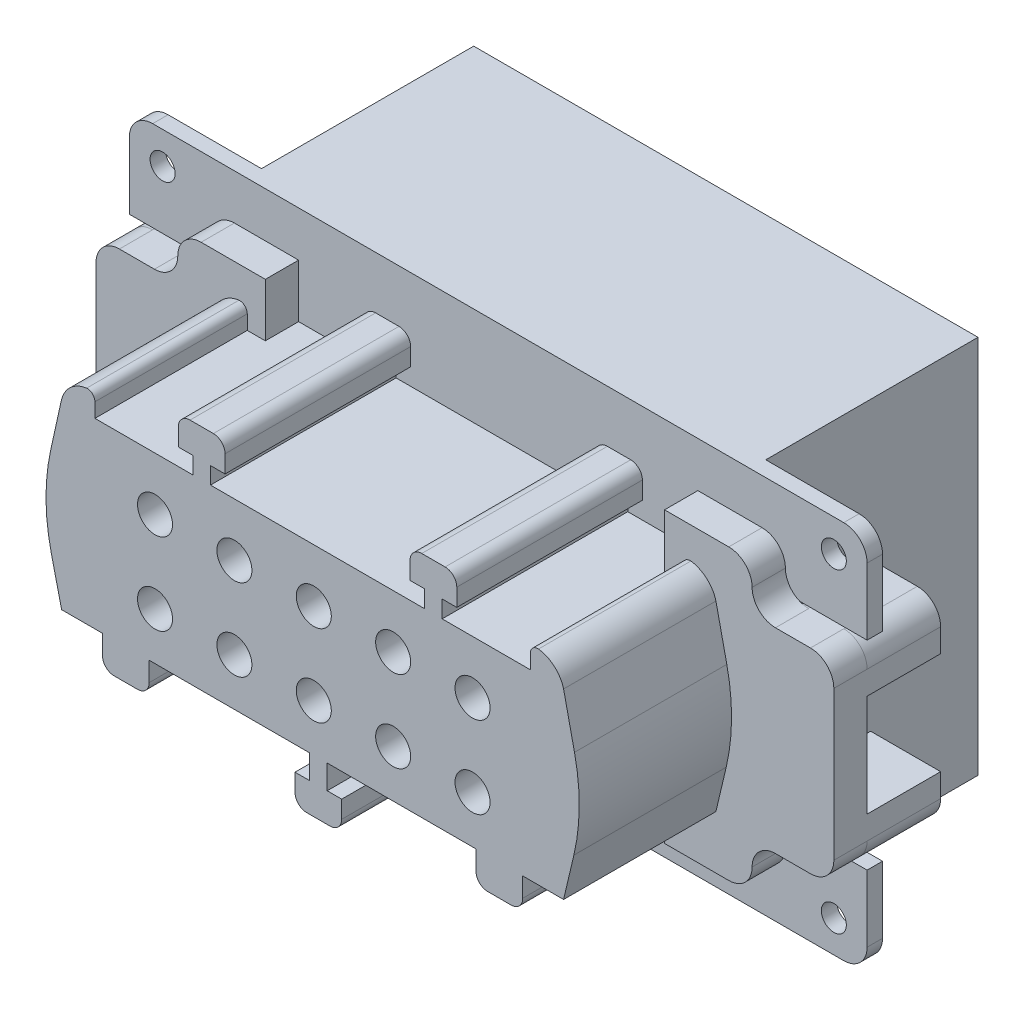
SolidWorks part; units mm, degrees
ref_plane "Front Plane" through (0, 0, 0) normal (0, 0, 1) x (1, 0, 0)
ref_plane "Top Plane" through (0, 0, 0) normal (0, 1, 0) x (1, 0, 0)
ref_plane "Right Plane" through (0, 0, 0) normal (1, 0, 0) x (0, 0, -1)
sketch "Sketch2" plane through (0, 0, 0) normal (0, 0, 1) x (1, 0, 0)
  line L0 (51.3412, 71.9453) -> (256.7061, 71.9453) construction
  line L1 (-14, -7.81) -> (-0.25, -7.81)
  line L2 (-21.5, -7.81) -> (-18, -7.81)
  line L4 (-18.6481, 7.81) -> (-10.25, 7.81)
  line L6 (-22.3805, -4.0782) -> (-21.5, -7.81)
  line L7 (-18.6481, 7.81) -> (-18.6481, 9.0397)
  line L8 (14, -7.81) -> (14, -10.47)
  line L13 (0, 16.6278) -> (0, -17.3382) construction
  line L15 (21.5, -7.81) -> (22.3805, -4.0782)
  line L16 (-21.5, -7.81) -> (21.5, 7.81) construction
  line L17 (-21.5, 7.81) -> (21.5, -7.81) construction
  line L18 (0.5, -13.0336) -> (0.5, -8.7302) construction
  line L19 (-18, -7.81) -> (-18, -10.47)
  line L20 (-18, -10.47) -> (-14, -10.47)
  line L21 (-14, -7.81) -> (-14, -10.47)
  line L22 (2.492, -12.3678) -> (-1.508, -12.3678)
  line L23 (2.492, -12.3678) -> (2.492, -9.8678)
  line L24 (2.492, -9.8678) -> (1.25, -9.8678)
  line L25 (-1.508, -12.3678) -> (-1.508, -9.8678)
  line L27 (-11.5, 9.2586) -> (-10.25, 9.2586)
  line L28 (-11.5, 9.2586) -> (-11.5, 11.7586)
  line L29 (-11.5, 11.7586) -> (-7.5, 11.7586)
  line L30 (-7.5, 9.2586) -> (-7.5, 11.7586)
  line L31 (8.35, 9.2858) -> (9.6, 9.2858)
  line L32 (8.35, 9.2858) -> (8.35, 11.7858)
  line L33 (-8.75, 9.2586) -> (-7.5, 9.2586)
  line L34 (8.35, 11.7858) -> (12.35, 11.7858)
  line L35 (12.35, 9.2858) -> (12.35, 11.7858)
  line L36 (1.25, -7.81) -> (14, -7.81)
  line L37 (-0.25, -9.8678) -> (-1.508, -9.8678)
  line L38 (-0.25, -7.81) -> (-0.25, -9.8678)
  line L39 (10.35, 12.8578) -> (10.35, 6.7253) construction
  line L40 (1.25, -7.81) -> (1.25, -9.8678)
  line L41 (-9.5, 14.8285) -> (-9.5, 6.5304) construction
  line L42 (11.1, 9.2858) -> (12.35, 9.2858)
  line L44 (9.6, 7.81) -> (9.6, 9.2858)
  line L45 (11.1, 7.81) -> (18.6481, 7.81)
  line L46 (11.1, 7.81) -> (11.1, 9.2858)
  line L48 (-10.25, 7.81) -> (-10.25, 9.2586)
  line L49 (-8.75, 7.81) -> (9.6, 7.81)
  line L50 (-8.75, 7.81) -> (-8.75, 9.2586)
  line L51 (18.6481, 7.81) -> (18.6481, 9.0397)
  line L52 (18, -10.47) -> (14, -10.47)
  line L53 (18, -7.81) -> (18, -10.47)
  line L54 (18, -7.81) -> (21.5, -7.81)
  line L57 (22.4335, 3.5745) -> (21.5, 7.81)
  line L68 (-22.4335, 3.5745) -> (-21.5, 7.81)
  arc A0 (-21.5, 7.81) -> (-19.3531, 9.7021) centre (-19.0071, 7.1455) cw
  arc A1 (-18.6481, 9.0397) -> (-19.3531, 9.7021) centre (-19.3118, 9.0397) ccw
  arc A2 (-22.3805, -4.0782) -> (-22.4335, 3.5745) centre (-5.6707, -0.1358) cw
  arc A8 (18.6481, 9.0397) -> (19.3531, 9.7021) centre (19.3118, 9.0397) cw
  arc A9 (22.3805, -4.0782) -> (22.4335, 3.5745) centre (5.6707, -0.1358) ccw
  arc A30 (21.5, 7.81) -> (19.3531, 9.7021) centre (19.0071, 7.1455) ccw
  point P2 (0, 0)
  point P36 (0, 1.0857)
  point P126 (0, 10.3439)
  point P128 (0, -12.569)
  point P134 (0, 28.6986)
  dimension "D1" = 15.62
  dimension "D2" = 43
  dimension "D14" = 2
  dimension "D3" = 4
  dimension "D4" = 0.5
  dimension "D5" = 4
  dimension "D6" = 2.5
  dimension "D7" = 4
  dimension "D8" = 2.5
  dimension "D9" = 2.5
  dimension "D10" = 4
  dimension "D11" = 0.75
  dimension "D12" = 1.5
  dimension "D13" = 2
  dimension "D15" = 1.5
  dimension "D16" = 0.75
  dimension "D17" = 1.5
  dimension "D18" = 0.75
  dimension "D19" = 10.35
  dimension "D20" = 9.5
extrude "Boss-Extrude1" add sketch "Sketch2" along normal blind 15.9
sketch "Sketch5" plane through (0, 0, 0) normal (0, 0, 1) x (1, 0, 0)
  line L1 (21.6, 16.25) -> (-21.6, 16.25)
  line L2 (21.6, 16.25) -> (21.6, -16.25)
  line L3 (21.6, -16.25) -> (-21.6, -16.25)
  line L4 (-21.6, 16.25) -> (-21.6, -16.25)
  line L5 (21.6, 16.25) -> (-21.6, -16.25) construction
  line L6 (21.6, -16.25) -> (-21.6, 16.25) construction
  point P0 (0, 0)
  dimension "D1" = 43.2
  dimension "D2" = 32.5
extrude "Boss-Extrude2" add sketch "Sketch5" against normal blind 19.5
sketch "Sketch7" plane through (0, 0, 0) normal (0, 0, 1) x (1, 0, 0)
  line L0 (38.8093, 0) -> (-38.8093, 0) construction
  line L1 (-17.1, 12.375) -> (-24.6, 12.375)
  line L2 (-17.1, 12.375) -> (-17.1, -12.375)
  line L3 (-17.1, -12.375) -> (-24.6, -12.375)
  line L4 (-24.6, 12.375) -> (-24.6, 8.375)
  line L5 (-17.1, 12.375) -> (-24.6, -12.375) construction
  line L6 (-17.1, -12.375) -> (-24.6, 12.375) construction
  line L7 (-21.6, -7.3862) -> (-21.6, -16.25) construction
  line L8 (-24.6, -8.375) -> (-24.6, -12.375)
  line L9 (-31.6, 8.375) -> (-24.6, 8.375)
  line L10 (-31.6, 8.375) -> (-31.6, -8.375)
  line L11 (-31.6, -8.375) -> (-24.6, -8.375)
  line L13 (-31.6, 8.375) -> (-24.6, -8.375) construction
  line L14 (-31.6, -8.375) -> (-24.6, 8.375) construction
  point P0 (-20.85, 0)
  point P9 (-28.1, 0)
  dimension "D1" = 7.5
  dimension "D2" = 4.5
  dimension "D3" = 24.75
  dimension "D4" = 16.75
  dimension "D5" = 7
extrude "Boss-Extrude3" add sketch "Sketch7" along normal blind 2.85
fillet "Fillet1" radius 2 6 edges at (-24.6, 12.375, 1.425) (-24.6, 8.375, 1.425) (-31.6, 8.375, 1.425) (-31.6, -8.375, 1.425) (-24.6, -8.375, 1.425) (-24.6, -12.375, 1.425)
mirror "Mirror1" about plane through (0, 0, 0) normal (1, 0, 0) of "Fillet1", "Boss-Extrude3"
sketch "Sketch9" plane through (0, 0, 0) normal (0, 0, -1) x (-1, 0, 0)
  line L0 (-26.6, 8.375) -> (-29.6, 8.375) construction
  line L1 (-25.6, 8.375) -> (-31.6, 8.375)
  line L2 (-25.6, 8.375) -> (-25.6, 4.375)
  line L3 (-25.6, 4.375) -> (-31.6, 4.375)
  line L4 (-31.6, 8.375) -> (-31.6, 4.375)
  line L5 (-31.6, 6.375) -> (-31.6, -6.375) construction
  dimension "D1" = 4
  dimension "D2" = 6
extrude "Boss-Extrude4" add sketch "Sketch9" along normal blind 6.3
mirror "Mirror7" about plane through (0, 0, 0) normal (0, 1, 0) of "Boss-Extrude4"
mirror "Mirror8" about plane through (0, 0, 0) normal (1, 0, 0) of "Mirror7", "Boss-Extrude4"
fillet "Fillet3" radius 2 4 edges at (-31.6, 8.375, -3.15) (-31.6, -8.375, -3.15) (31.6, 8.375, -3.15) (31.6, -8.375, -3.15)
sketch "Sketch10" plane through (0, 0, -19.5) normal (0, 0, -1) x (-1, 0, 0)
  line L1 (38.8093, 0) -> (-38.8093, 0) construction
  line L2 (0, 55) -> (0, -55) construction
  circle A0 centre (13.5, -3.75) radius 1.5
  dimension "D1" = 3
  dimension "D2" = 3.75
  dimension "D3" = 13.5
extrude "Cut-Extrude1" cut sketch "Sketch10" against normal through all
pattern_linear "LPattern1" count 5 spacing 6.8 along (1, 0, 0) count 2 spacing 7 along (0, 1, 0) of "Cut-Extrude1"
sketch "Sketch11" plane through (0, 0, -19.5) normal (0, 0, -1) x (-1, 0, 0)
  line L0 (13.5, -3.75) -> (13.5, -7.6445) construction
  line L1 (15.45, -5.3932) -> (15.45, -5.9932)
  line L2 (11.55, -5.3932) -> (11.55, -5.9932)
  arc A0 (15.45, -5.3932) -> (11.55, -5.3932) centre (13.5, -3.75) ccw
  arc A1 (15.45, -5.9932) -> (11.55, -5.9932) centre (13.5, -4.35) cw
  dimension "D1" = 5.1
  dimension "D2" = 2.55
  dimension "D3" = 0.6
  dimension "D4" = 3.9
extrude "Cut-Extrude2" cut sketch "Sketch11" against normal blind 33.15
pattern_linear "LPattern2" count 5 spacing 6.8 along (1, 0, 0) count 2 spacing 10 along (0, 0, -1) of "Cut-Extrude2"
sketch "Sketch12" plane through (0, 0, 0) normal (0, 0, 1) x (1, 0, 0)
  line L1 (-21.6, 16.25) -> (-31.6, 16.25)
  line L2 (-21.6, 16.25) -> (-21.6, 8.5287)
  line L3 (-21.6, 8.5287) -> (-31.6, 8.5287)
  line L4 (-31.6, 16.25) -> (-31.6, 8.5287)
extrude "Boss-Extrude5" add sketch "Sketch12" against normal blind 1.32
fillet "Fillet4" radius 2 1 edges at (-31.6, 16.25, -0.66)
sketch "Sketch13" plane through (0, 0, 0) normal (0, 0, 1) x (1, 0, 0)
  line L0 (0, -55) -> (0, 55) construction
  line L1 (38.8093, 0) -> (-38.8093, 0) construction
  circle A0 centre (-28.75, 13.5) radius 1.0717
  dimension "D1" = 28.75
  dimension "D2" = 13.5
extrude "Cut-Extrude6" cut sketch "Sketch13" against normal through all
mirror "Mirror9" about plane through (0, 0, 0) normal (0, 1, 0) of "Cut-Extrude6", "Fillet4", "Boss-Extrude5"
mirror "Mirror10" about plane through (0, 0, 0) normal (1, 0, 0) of "Mirror9", "Cut-Extrude6", "Fillet4", "Boss-Extrude5"
mirror "Mirror11" about plane through (0, 0, 0) normal (0, 1, 0) of "Cut-Extrude2", "LPattern2"
fillet "Fillet5" radius 1 10 edges at (12.35, 11.7858, 7.95) (8.35, 11.7858, 7.95) (-7.5, 11.7586, 7.95) (-11.5, 11.7586, 7.95) (-18, -10.47, 9.375) (-14, -10.47, 7.95) (-1.508, -12.3678, 7.95) (2.492, -12.3678, 7.95) (14, -10.47, 7.95) (18, -10.47, 9.375)
